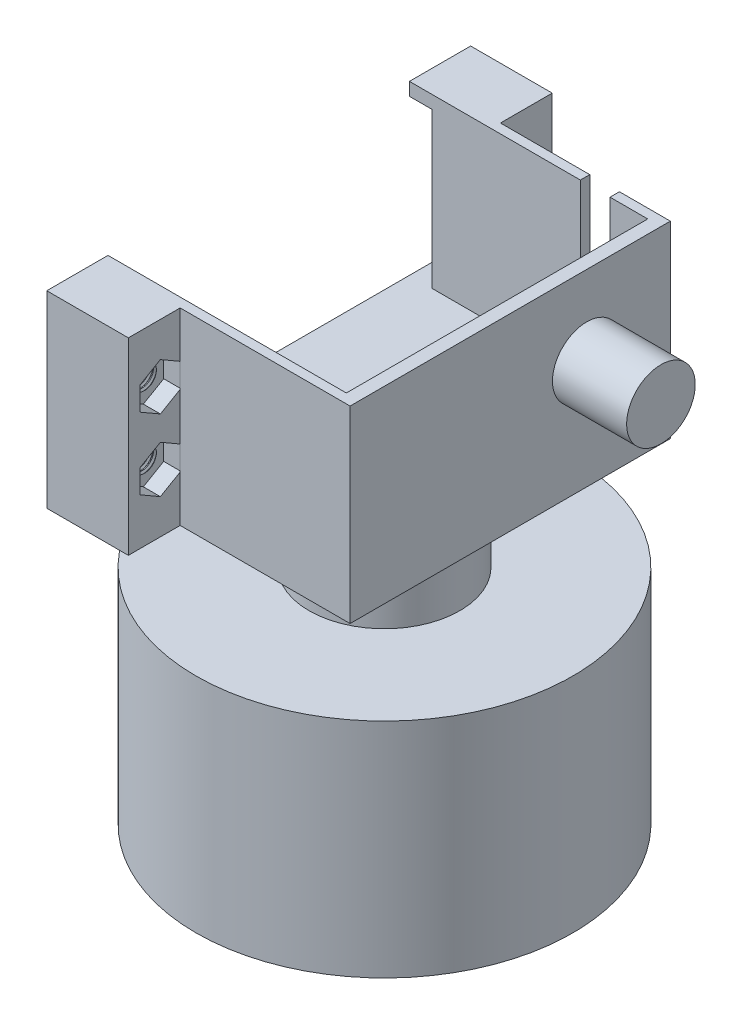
SolidWorks part; units mm, degrees
ref_plane "Front Plane" through (0, 0, 0) normal (0, 0, 1) x (1, 0, 0)
ref_plane "Top Plane" through (0, 0, 0) normal (0, 1, 0) x (1, 0, 0)
ref_plane "Right Plane" through (0, 0, 0) normal (1, 0, 0) x (0, 0, -1)
sketch "Sketch1" plane through (0, 0, 0) normal (0, 1, 0) x (1, 0, 0)
  circle A0 centre (0, 0) radius 25.4
  dimension "D1" = 50.8
extrude "Boss-Extrude1" add sketch "Sketch1" along normal blind 30
sketch "Sketch18" plane through (0, 0, 0) normal (0, -1, 0) x (1, 0, 0)
  line L0 (-8.15, 9.4777) -> (-8.15, -9.4777)
  arc A0 (-8.15, -9.4777) -> (-8.15, 9.4777) centre (0, 0) ccw
  dimension "D1" = 25
  dimension "D2" = 8.15
extrude "Cut-Extrude14" cut sketch "Sketch18" against normal blind 25
sketch "Sketch4" plane through (0, 30, 0) normal (0, 1, 0) x (1, 0, 0)
  circle A0 centre (0, 0) radius 10.16
  point P0 (0, 0)
  dimension "D3" = 20.32
extrude "Boss-Extrude3" add sketch "Sketch4" along normal blind 12.7
sketch "Sketch7" plane through (0, 42.7, 0) normal (0, 1, 0) x (1, 0, 0)
  line L1 (-16.955, -28.575) -> (16.955, -28.575)
  line L2 (-16.955, -28.575) -> (-16.955, 28.575)
  line L3 (-16.955, 28.575) -> (16.955, 28.575)
  line L4 (16.955, -28.575) -> (16.955, 28.575)
  line L5 (-16.955, -28.575) -> (16.955, 28.575) construction
  line L6 (-16.955, 28.575) -> (16.955, -28.575) construction
  point P0 (0, 0)
  dimension "D1" = 33.91
  dimension "D2" = 57.15
extrude "Boss-Extrude4" add sketch "Sketch7" along normal blind 25.4
sketch "Sketch10" plane through (-16.955, 0, 0) normal (-1, 0, 0) x (0, 0, 1)
  line L0 (0, 68.1) -> (0, 42.7) construction
  line L1 (-28.575, 68.1) -> (28.575, 68.1) construction
  line L2 (-28.575, 42.7) -> (28.575, 42.7) construction
  line L3 (-28.575, 55.4) -> (28.575, 55.4) construction
  line L4 (-28.575, 68.1) -> (-28.575, 42.7) construction
  line L5 (28.575, 68.1) -> (28.575, 42.7) construction
  circle A0 centre (-24.257, 60.226) radius 1.5
  circle A1 centre (-24.257, 50.574) radius 1.5
  circle A2 centre (24.257, 50.574) radius 1.5
  circle A3 centre (24.257, 60.226) radius 1.5
  dimension "D1" = 3
  dimension "D2" = 9.652
  dimension "D3" = 24.257
extrude "Cut-Extrude8" cut sketch "Sketch10" against normal up to next
sketch "Sketch11" plane through (-16.955, 0, 0) normal (-1, 0, 0) x (0, 0, 1)
  line L1 (-28.575, 68.1) -> (28.575, 68.1) construction
  line L3 (-28.575, 55.4) -> (28.575, 55.4) construction
  line L4 (-28.575, 68.1) -> (-28.575, 42.7) construction
  line L5 (28.575, 68.1) -> (28.575, 42.7) construction
  line L6 (-28.575, 42.7) -> (28.575, 42.7) construction
  line L7 (-20.32, 45.45) -> (20.32, 45.45)
  line L8 (-20.32, 45.45) -> (-20.32, 68.1)
  line L9 (-20.32, 68.1) -> (20.32, 68.1)
  line L10 (20.32, 45.45) -> (20.32, 68.1)
  point P12 (0, 55.4)
  dimension "D1" = 40.64
  dimension "D3" = 2.75
  dimension "D4" = 8.255
extrude "Cut-Extrude9" cut sketch "Sketch11" against normal blind 32.132
sketch "Sketch12" plane through (-16.955, 0, 0) normal (-1, 0, 0) x (0, 0, 1)
  line L0 (0, 68.1) -> (0, 42.7) construction
  line L1 (-20.32, 45.45) -> (20.32, 45.45) construction
  line L2 (-28.575, 68.1) -> (-20.32, 68.1) construction
  line L3 (-20.32, 68.1) -> (-20.32, 45.45) construction
  line L8 (-28.575, 55.4) -> (28.575, 55.4) construction
  line L9 (-28.575, 68.1) -> (-28.575, 42.7) construction
  line L10 (28.575, 68.1) -> (28.575, 42.7) construction
  line L12 (-27.94, 66.35) -> (-20.32, 66.35)
  line L13 (-27.94, 66.35) -> (-27.94, 45.45)
  line L14 (-27.94, 45.45) -> (-20.32, 45.45)
  line L15 (-20.32, 66.35) -> (-20.32, 45.45)
  line L20 (-10.16, 42.7) -> (10.16, 42.7) construction
  line L21 (20.32, 68.1) -> (-20.32, 68.1) construction
  line L22 (27.94, 45.45) -> (20.32, 45.45)
  line L23 (20.32, 66.35) -> (20.32, 45.45)
  line L24 (27.94, 66.35) -> (20.32, 66.35)
  line L25 (27.94, 66.35) -> (27.94, 45.45)
  dimension "D1" = 1.75
  dimension "D3" = 0.635
extrude "Cut-Extrude10" cut sketch "Sketch12" against normal blind 3.048
sketch "Sketch13" plane through (0, 68.1, 0) normal (0, 1, 0) x (1, 0, 0)
  line L0 (-16.955, 0) -> (16.955, 0) construction
  line L1 (-16.955, 27.94) -> (-16.955, -27.94) construction
  line L2 (16.955, -28.575) -> (16.955, 28.575) construction
  line L3 (15.177, 20.32) -> (-16.955, 20.32) construction
  line L4 (16.955, 28.575) -> (-5.955, 28.575)
  line L5 (16.955, 28.575) -> (16.955, 21.59)
  line L6 (16.955, 21.59) -> (-5.955, 21.59)
  line L7 (-5.955, 28.575) -> (-5.955, 21.59)
  line L8 (16.955, -21.59) -> (-5.955, -21.59)
  line L9 (-5.955, -28.575) -> (-5.955, -21.59)
  line L10 (16.955, -28.575) -> (-5.955, -28.575)
  line L11 (16.955, -28.575) -> (16.955, -21.59)
  line L12 (-16.955, 28.575) -> (-16.955, 20.32) construction
  dimension "D1" = 1.27
  dimension "D2" = 11
extrude "Cut-Extrude11" cut sketch "Sketch13" against normal up to next
sketch "Sketch15" plane through (-16.955, 0, 0) normal (-1, 0, 0) x (0, 0, 1)
  line L0 (-20.32, 68.1) -> (-20.32, 45.45) construction
  line L4 (-20.32, 66.35) -> (-27.94, 66.35) construction
  circle A0 centre (-10.32, 57.35) radius 3 construction
  dimension "D1" = 6
  dimension "D2" = 10
  dimension "D3" = 9
sketch "Sketch16" plane through (16.955, 0, 0) normal (1, 0, 0) x (0, 0, -1)
  circle A0 centre (10.32, 57.35) radius 4.625
  dimension "D1" = 9.25
extrude "Boss-Extrude6" add sketch "Sketch16" along normal blind 10
thread "Thread1" pitch 0.5 start angle 0, offset 0, length 0, pitch 0.5, diameter 3
ref_plane "Plane1" through (-13.907, 60.226, -25.757) normal (0, -1, 0) x (0, 0, -1)
sketch "Thread Profile1" plane through (-13.907, 60.226, -25.757) normal (0, -1, 0) x (0, 0, -1)
  line L0 (0, 0) -> (0, 0.5) construction
  line L1 (0, 0) -> (0.2706, 0.1562)
  line L2 (0.2706, 0.1562) -> (0.2706, 0.2187)
  line L3 (0.2706, 0.2187) -> (0, 0.375)
  line L4 (0.2706, 0.1875) -> (0, 0.1875) construction
  line L11 (0, 0) -> (0, 0.375)
  point P2 (0, 0)
  dimension "Pitch" = 0.5
  dimension "Profile_Angle" = 60
  dimension "Profile_Land" = 0.0625
  dimension "Profile_Height" = 0.2706
thread "Thread2" pitch 0.5 start angle 0, offset 0, length 0, pitch 0.5, diameter 3
ref_plane "Plane2" through (-13.907, 50.574, -25.757) normal (0, -1, 0) x (0, 0, -1)
sketch "Thread Profile2" plane through (-13.907, 50.574, -25.757) normal (0, -1, 0) x (0, 0, -1)
  line L0 (0, 0) -> (0, 0.5) construction
  line L1 (0, 0) -> (0.2706, 0.1562)
  line L2 (0.2706, 0.1562) -> (0.2706, 0.2187)
  line L3 (0.2706, 0.2187) -> (0, 0.375)
  line L4 (0.2706, 0.1875) -> (0, 0.1875) construction
  line L11 (0, 0) -> (0, 0.375)
  point P2 (0, 0)
  dimension "Pitch" = 0.5
  dimension "Profile_Angle" = 60
  dimension "Profile_Land" = 0.0625
  dimension "Profile_Height" = 0.2706
thread "Thread3" pitch 0.5 start angle 0, offset 0, length 0, pitch 0.5, diameter 3
ref_plane "Plane3" through (-13.907, 60.226, 22.757) normal (0, -1, 0) x (0, 0, -1)
sketch "Thread Profile3" plane through (-13.907, 60.226, 22.757) normal (0, -1, 0) x (0, 0, -1)
  line L0 (0, 0) -> (0, 0.5) construction
  line L1 (0, 0) -> (0.2706, 0.1562)
  line L2 (0.2706, 0.1562) -> (0.2706, 0.2187)
  line L3 (0.2706, 0.2187) -> (0, 0.375)
  line L4 (0.2706, 0.1875) -> (0, 0.1875) construction
  line L11 (0, 0) -> (0, 0.375)
  point P2 (0, 0)
  dimension "Pitch" = 0.5
  dimension "Profile_Angle" = 60
  dimension "Profile_Land" = 0.0625
  dimension "Profile_Height" = 0.2706
thread "Thread4" pitch 0.5 start angle 0, offset 0, length 0, pitch 0.5, diameter 3
ref_plane "Plane4" through (-13.907, 50.574, 22.757) normal (0, -1, 0) x (0, 0, -1)
sketch "Thread Profile4" plane through (-13.907, 50.574, 22.757) normal (0, -1, 0) x (0, 0, -1)
  line L0 (0, 0) -> (0, 0.5) construction
  line L1 (0, 0) -> (0.2706, 0.1562)
  line L2 (0.2706, 0.1562) -> (0.2706, 0.2187)
  line L3 (0.2706, 0.2187) -> (0, 0.375)
  line L4 (0.2706, 0.1875) -> (0, 0.1875) construction
  line L11 (0, 0) -> (0, 0.375)
  point P2 (0, 0)
  dimension "Pitch" = 0.5
  dimension "Profile_Angle" = 60
  dimension "Profile_Land" = 0.0625
  dimension "Profile_Height" = 0.2706
sketch "Sketch17" plane through (0, 0, -21.59) normal (0, 0, -1) x (-1, 0, 0)
  line L0 (-10.093, 68.1) -> (-6.093, 68.1)
  line L1 (-6.093, 68.1) -> (-6.093, 52.1)
  line L2 (-10.093, 68.1) -> (-10.093, 52.1)
  line L4 (13.907, 45.45) -> (13.907, 66.35) construction
  line L5 (5.955, 42.7) -> (-16.955, 42.7) construction
  line L6 (5.955, 68.1) -> (-16.955, 68.1) construction
  arc A0 (-10.093, 52.1) -> (-6.093, 52.1) centre (-8.093, 52.1) ccw
  dimension "D3" = 9.4
  dimension "D1" = 20
  dimension "D2" = 4
extrude "Cut-Extrude13" cut sketch "Sketch17" against normal up to next
sketch "Sketch19" plane through (-5.955, 0, 0) normal (1, 0, 0) x (0, 0, -1)
  line L7 (-24.257, 57.0506) -> (-21.507, 58.6383)
  line L8 (-21.507, 58.6383) -> (-21.507, 61.8137)
  line L9 (-21.507, 61.8137) -> (-24.257, 63.4014)
  line L10 (-24.257, 63.4014) -> (-27.007, 61.8137)
  line L11 (-27.007, 61.8137) -> (-27.007, 58.6383)
  line L12 (-27.007, 58.6383) -> (-24.257, 57.0506)
  line L13 (-28.575, 55.4) -> (28.575, 55.4) construction
  line L14 (-28.575, 42.7) -> (-28.575, 68.1) construction
  line L15 (28.575, 42.7) -> (28.575, 68.1) construction
  line L16 (0, 68.1) -> (0, 42.7) construction
  line L17 (-21.59, 68.1) -> (21.59, 68.1) construction
  line L18 (-21.59, 42.7) -> (21.59, 42.7) construction
  line L19 (-27.007, 52.1617) -> (-24.257, 53.7494)
  line L20 (-27.007, 48.9863) -> (-27.007, 52.1617)
  line L21 (-24.257, 47.3986) -> (-27.007, 48.9863)
  line L22 (-21.507, 48.9863) -> (-24.257, 47.3986)
  line L23 (-21.507, 52.1617) -> (-21.507, 48.9863)
  line L24 (-24.257, 53.7494) -> (-21.507, 52.1617)
  line L25 (27.007, 58.6383) -> (24.257, 57.0506)
  line L26 (27.007, 61.8137) -> (27.007, 58.6383)
  line L27 (24.257, 63.4014) -> (27.007, 61.8137)
  line L28 (21.507, 61.8137) -> (24.257, 63.4014)
  line L29 (21.507, 58.6383) -> (21.507, 61.8137)
  line L30 (24.257, 57.0506) -> (21.507, 58.6383)
  line L31 (27.007, 48.9863) -> (27.007, 52.1617)
  line L32 (24.257, 47.3986) -> (27.007, 48.9863)
  line L33 (21.507, 48.9863) -> (24.257, 47.3986)
  line L34 (21.507, 52.1617) -> (21.507, 48.9863)
  line L35 (24.257, 53.7494) -> (21.507, 52.1617)
  line L36 (27.007, 52.1617) -> (24.257, 53.7494)
  circle A0 centre (-24.257, 60.226) radius 2.75 construction
  dimension "D1" = 5.5
extrude "Cut-Extrude15" cut sketch "Sketch19" against normal blind 2.3
